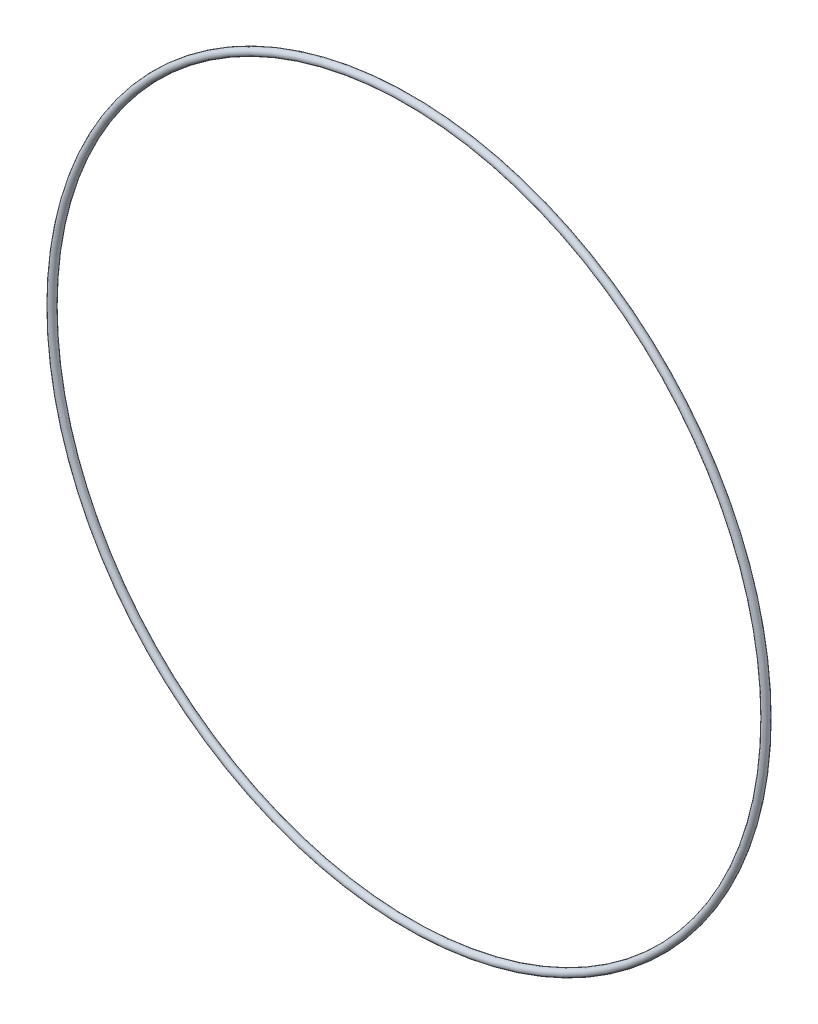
SolidWorks part; units mm, degrees
ref_plane "Front Plane" through (0, 0, 0) normal (0, 0, 1) x (1, 0, 0)
ref_plane "Top Plane" through (0, 0, 0) normal (0, 1, 0) x (1, 0, 0)
ref_plane "Right Plane" through (0, 0, 0) normal (1, 0, 0) x (0, 0, -1)
sketch "Sketch1" plane through (0, 0, 0) normal (0, 1, 0) x (1, 0, 0)
  line L0 (0, 0) -> (0, -68.4927)
  line L1 (-147, 0) -> (0, 0)
  circle A0 centre (-147, 0) radius 1.5
  dimension "D1" = 147
revolve "Revolve1" add sketch "Sketch1" angle 360 about L0
